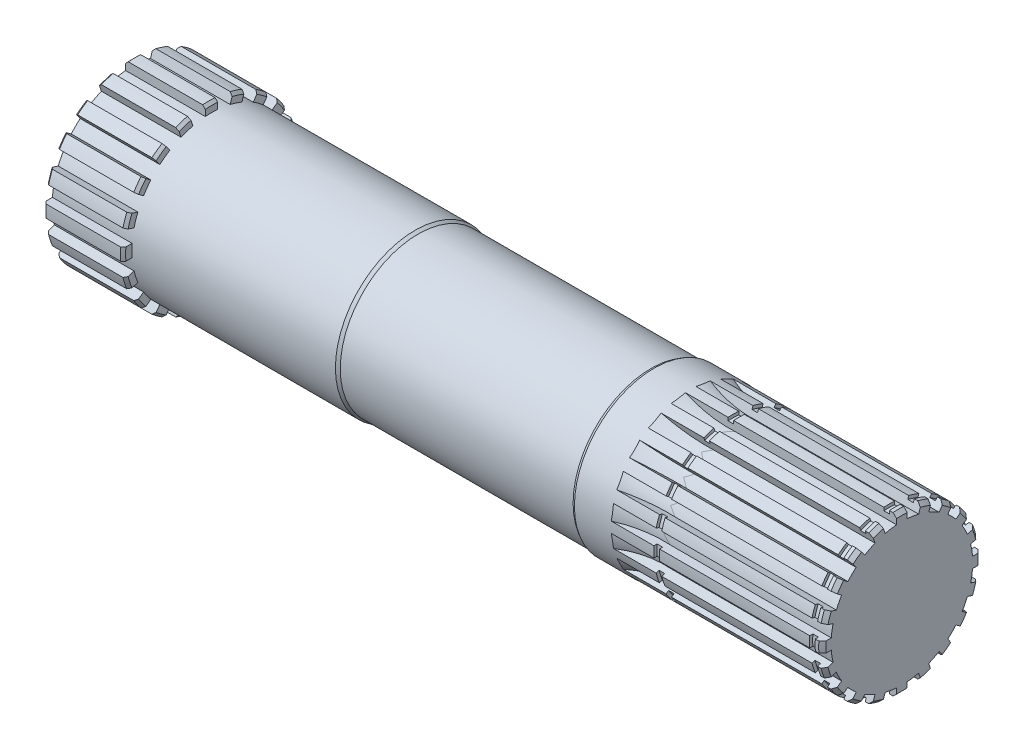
SolidWorks part; units mm, degrees
ref_plane "Face" through (0, 0, 0) normal (0, 0, 1) x (1, 0, 0)
ref_plane "Dessus" through (0, 0, 0) normal (0, 1, 0) x (1, 0, 0)
ref_plane "Droite" through (0, 0, 0) normal (1, 0, 0) x (0, 0, -1)
sketch "Esquisse1" plane through (0, 0, 0) normal (0, 0, 1) x (1, 0, 0)
  line L0 (-78.8416, 3.5275) -> (479.443, 3.5275) construction
  line L1 (-48.0336, 3.5275) -> (-48.0336, 52.0275)
  line L2 (-46.5336, 53.5275) -> (-4.5336, 53.5275)
  line L3 (-3.0336, 52.0275) -> (-3.0336, 48.5275)
  line L4 (-3.0336, 48.5275) -> (111.9664, 48.5275)
  line L5 (111.9664, 48.5275) -> (113.6984, 47.5275)
  line L6 (113.6984, 47.5275) -> (245.2343, 47.5275)
  line L7 (245.2343, 47.5275) -> (246.9664, 48.5275)
  line L8 (246.9664, 48.5275) -> (291.8164, 48.5275)
  line L9 (386.9664, 46.5275) -> (386.9664, 3.5275)
  line L10 (-48.0336, 52.0275) -> (-46.5336, 53.5275)
  line L11 (-4.5336, 53.5275) -> (-3.0336, 52.0275)
  line L12 (384.9664, 48.5275) -> (386.9664, 46.5275)
  line L13 (294.9664, 48.5275) -> (379.8164, 48.5275)
  line L14 (382.9664, 48.5275) -> (384.9664, 48.5275)
  line L15 (379.8164, 48.5275) -> (379.8164, 46.7775)
  line L16 (379.8164, 46.7775) -> (382.9664, 46.7775)
  line L17 (382.9664, 48.5275) -> (382.9664, 46.7775)
  line L18 (-48.0336, 3.5275) -> (386.9664, 3.5275)
  line L19 (291.8164, 48.5275) -> (291.8164, 46.7775)
  line L20 (291.8164, 46.7775) -> (294.9664, 46.7775)
  line L21 (294.9664, 48.5275) -> (294.9664, 46.7775)
  point P4 (-48.0336, 53.5275)
  point P6 (-3.0336, 53.5275)
  point P12 (386.9664, 48.5275)
  dimension "D1" = 100
  dimension "D2" = 90
  dimension "D3" = 88
  dimension "D4" = 90
  dimension "D5" = 45
  dimension "D6" = 115
  dimension "D7" = 435
  dimension "D8" = 150
  dimension "D9" = 150
  dimension "D10" = 135
  dimension "D11" = 1.5
  dimension "D12" = 45
  dimension "D13" = 1.5
  dimension "D14" = 45
  dimension "D15" = 2
  dimension "D16" = 45
  dimension "D17" = 3.15
  dimension "D18" = 3.15
  dimension "D19" = 386
  dimension "D20" = 298
  dimension "D21" = 86.5
revolve "Révolution1" add sketch "Esquisse1" angle 360 about L0
sketch "Esquisse2" plane through (-48.0336, 0, 0) normal (-1, 0, 0) x (0, 0, 1)
  line L0 (0, 3.5275) -> (0, 70.5299) construction
  line L1 (12.8849, 54.5095) -> (10.5349, 47.2769)
  line L3 (-3.5, 55.9959) -> (-3.5, 48.3912)
  line L5 (3.5, 55.9959) -> (3.5, 48.3912)
  line L6 (19.5423, 52.3464) -> (17.1923, 45.1138)
  line L7 (28.0086, 48.0326) -> (23.5387, 41.8802)
  line L9 (33.6717, 43.9181) -> (29.2018, 37.7657)
  line L10 (40.3906, 37.1992) -> (34.2382, 32.7292)
  line L12 (44.5051, 31.5361) -> (38.3527, 27.0661)
  line L13 (48.8189, 23.0698) -> (41.5863, 20.7198)
  line L15 (50.982, 16.4124) -> (43.7495, 14.0624)
  line L16 (52.4684, 7.0275) -> (44.8637, 7.0275)
  line L18 (52.4684, 0.0275) -> (44.8637, 0.0275)
  line L19 (50.982, -9.3575) -> (43.7495, -7.0075)
  line L21 (48.8189, -16.0149) -> (41.5863, -13.6649)
  line L22 (44.5051, -24.4811) -> (38.3527, -20.0112)
  line L24 (40.3906, -30.1443) -> (34.2382, -25.6743)
  line L25 (33.6717, -36.8631) -> (29.2018, -30.7108)
  line L27 (28.0086, -40.9776) -> (23.5387, -34.8253)
  line L28 (19.5423, -45.2914) -> (17.1923, -38.0589)
  line L30 (12.8849, -47.4545) -> (10.5349, -40.222)
  line L31 (3.5, -48.941) -> (3.5, -41.3362)
  line L33 (-3.5, -48.941) -> (-3.5, -41.3362)
  line L34 (-12.8849, -47.4545) -> (-10.5349, -40.222)
  line L36 (-19.5423, -45.2914) -> (-17.1923, -38.0589)
  line L37 (-28.0086, -40.9776) -> (-23.5387, -34.8253)
  line L39 (-33.6717, -36.8631) -> (-29.2018, -30.7108)
  line L40 (-40.3906, -30.1443) -> (-34.2382, -25.6743)
  line L42 (-44.5051, -24.4811) -> (-38.3527, -20.0112)
  line L43 (-48.8189, -16.0149) -> (-41.5863, -13.6649)
  line L45 (-50.982, -9.3575) -> (-43.7495, -7.0075)
  line L46 (-52.4684, 0.0275) -> (-44.8637, 0.0275)
  line L48 (-52.4684, 7.0275) -> (-44.8637, 7.0275)
  line L49 (-50.982, 16.4124) -> (-43.7495, 14.0624)
  line L51 (-48.8189, 23.0698) -> (-41.5863, 20.7198)
  line L52 (-44.5051, 31.5361) -> (-38.3527, 27.0661)
  line L54 (-40.3906, 37.1992) -> (-34.2382, 32.7292)
  line L55 (-33.6717, 43.9181) -> (-29.2018, 37.7657)
  line L57 (-28.0086, 48.0326) -> (-23.5387, 41.8802)
  line L58 (-19.5423, 52.3464) -> (-17.1923, 45.1138)
  line L60 (-12.8849, 54.5095) -> (-10.5349, 47.2769)
  line L61 (-20.5467, 55.4375) -> (-13.8893, 57.6006)
  line L62 (-35.5822, 46.5476) -> (-29.919, 50.6621)
  line L63 (-47.1346, 33.4465) -> (-43.0201, 39.1096)
  line L64 (-54.0732, 17.4168) -> (-51.91, 24.0742)
  line L65 (-55.7187, 0.0275) -> (-55.7187, 7.0275)
  line L66 (-51.91, -17.0192) -> (-54.0732, -10.3618)
  line L67 (-43.0201, -32.0547) -> (-47.1346, -26.3916)
  line L68 (0, 59.2461) -> (3.5, 59.2461)
  line L69 (13.8893, 57.6006) -> (20.5467, 55.4375)
  line L70 (29.919, 50.6621) -> (35.5822, 46.5476)
  line L71 (43.0201, 39.1096) -> (47.1346, 33.4465)
  line L72 (51.91, 24.0742) -> (54.0732, 17.4168)
  line L73 (55.7187, 7.0275) -> (55.7187, 0.0275)
  line L74 (54.0732, -10.3618) -> (51.91, -17.0192)
  line L75 (47.1346, -26.3916) -> (43.0201, -32.0547)
  line L76 (35.5822, -39.4926) -> (29.919, -43.6071)
  line L77 (20.5467, -48.3826) -> (13.8893, -50.5457)
  line L78 (3.5, -52.1912) -> (-3.5, -52.1912)
  line L79 (-13.8893, -50.5457) -> (-20.5467, -48.3826)
  line L80 (-29.919, -43.6071) -> (-35.5822, -39.4926)
  arc A0 (-3.5, 48.3912) -> (-10.5349, 47.2769) centre (0, 3.5275) ccw
  arc A1 (-40.3906, -30.1443) -> (-33.6717, -36.8631) centre (0, 3.5275) ccw
  arc A2 (10.5349, 47.2769) -> (3.5, 48.3912) centre (0, 3.5275) ccw
  arc A3 (23.5387, 41.8802) -> (17.1923, 45.1138) centre (0, 3.5275) ccw
  arc A4 (34.2382, 32.7292) -> (29.2018, 37.7657) centre (0, 3.5275) ccw
  arc A5 (41.5863, 20.7198) -> (38.3527, 27.0661) centre (0, 3.5275) ccw
  arc A6 (44.8637, 7.0275) -> (43.7495, 14.0624) centre (0, 3.5275) ccw
  arc A7 (43.7495, -7.0075) -> (44.8637, 0.0275) centre (0, 3.5275) ccw
  arc A8 (38.3527, -20.0112) -> (41.5863, -13.6649) centre (0, 3.5275) ccw
  arc A9 (29.2018, -30.7108) -> (34.2382, -25.6743) centre (0, 3.5275) ccw
  arc A10 (17.1923, -38.0589) -> (23.5387, -34.8253) centre (0, 3.5275) ccw
  arc A11 (3.5, -41.3362) -> (10.5349, -40.222) centre (0, 3.5275) ccw
  arc A12 (-10.5349, -40.222) -> (-3.5, -41.3362) centre (0, 3.5275) ccw
  arc A13 (-23.5387, -34.8253) -> (-17.1923, -38.0589) centre (0, 3.5275) ccw
  arc A14 (-34.2382, -25.6743) -> (-29.2018, -30.7108) centre (0, 3.5275) ccw
  arc A15 (-41.5863, -13.6649) -> (-38.3527, -20.0112) centre (0, 3.5275) ccw
  arc A16 (-44.8637, 0.0275) -> (-43.7495, -7.0075) centre (0, 3.5275) ccw
  arc A17 (-43.7495, 14.0624) -> (-44.8637, 7.0275) centre (0, 3.5275) ccw
  arc A18 (-38.3527, 27.0661) -> (-41.5863, 20.7198) centre (0, 3.5275) ccw
  arc A19 (-29.2018, 37.7657) -> (-34.2382, 32.7292) centre (0, 3.5275) ccw
  arc A20 (-17.1923, 45.1138) -> (-23.5387, 41.8802) centre (0, 3.5275) ccw
  arc A21 (-48.8189, -16.0149) -> (-44.5051, -24.4811) centre (0, 3.5275) ccw
  arc A22 (-52.4684, 0.0275) -> (-50.982, -9.3575) centre (0, 3.5275) ccw
  arc A23 (-50.982, 16.4124) -> (-52.4684, 7.0275) centre (0, 3.5275) ccw
  arc A24 (-44.5051, 31.5361) -> (-48.8189, 23.0698) centre (0, 3.5275) ccw
  arc A25 (-33.6717, 43.9181) -> (-40.3906, 37.1992) centre (0, 3.5275) ccw
  arc A26 (-19.5423, 52.3464) -> (-28.0086, 48.0326) centre (0, 3.5275) ccw
  arc A27 (-3.5, 55.9959) -> (-12.8849, 54.5095) centre (0, 3.5275) ccw
  arc A28 (28.0086, 48.0326) -> (19.5423, 52.3464) centre (0, 3.5275) ccw
  arc A29 (12.8849, 54.5095) -> (3.5, 55.9959) centre (0, 3.5275) ccw
  arc A30 (40.3906, 37.1992) -> (33.6717, 43.9181) centre (0, 3.5275) ccw
  arc A31 (48.8189, 23.0698) -> (44.5051, 31.5361) centre (0, 3.5275) ccw
  arc A32 (52.4684, 7.0275) -> (50.982, 16.4124) centre (0, 3.5275) ccw
  arc A33 (50.982, -9.3575) -> (52.4684, 0.0275) centre (0, 3.5275) ccw
  arc A34 (44.5051, -24.4811) -> (48.8189, -16.0149) centre (0, 3.5275) ccw
  arc A35 (33.6717, -36.8631) -> (40.3906, -30.1443) centre (0, 3.5275) ccw
  arc A36 (19.5423, -45.2914) -> (28.0086, -40.9776) centre (0, 3.5275) ccw
  arc A37 (3.5, -48.941) -> (12.8849, -47.4545) centre (0, 3.5275) ccw
  arc A38 (-12.8849, -47.4545) -> (-3.5, -48.941) centre (0, 3.5275) ccw
  arc A39 (-28.0086, -40.9776) -> (-19.5423, -45.2914) centre (0, 3.5275) ccw
  dimension "D1" = 3.5
  dimension "D3" = 90
  dimension "D2" = 3.5
extrude "Enlèv. mat.-Extru.1" cut sketch "Esquisse2" against normal blind 45
sketch "Esquisse3" plane through (386.9664, 0, 0) normal (1, 0, 0) x (0, 0, -1)
  line L0 (0, 3.5275) -> (0, 69.0717) construction
  line L1 (11.7386, 49.3632) -> (9.4727, 42.3896)
  line L2 (-3, 50.7473) -> (3, 50.7473)
  line L3 (-3, 50.7473) -> (-3, 43.4148)
  line L4 (11.7386, 49.3632) -> (17.4449, 47.5091)
  line L5 (3, 50.7473) -> (3, 43.4148)
  line L6 (17.4449, 47.5091) -> (15.179, 40.5355)
  line L7 (25.3281, 43.4925) -> (21.0181, 37.5604)
  line L8 (25.3281, 43.4925) -> (30.1822, 39.9658)
  line L9 (30.1822, 39.9658) -> (25.8722, 34.0337)
  line L10 (36.4383, 33.7096) -> (30.5062, 29.3997)
  line L11 (36.4383, 33.7096) -> (39.965, 28.8555)
  line L12 (39.965, 28.8555) -> (34.0329, 24.5456)
  line L13 (43.9817, 20.9724) -> (37.0081, 18.7065)
  line L14 (43.9817, 20.9724) -> (45.8358, 15.266)
  line L15 (45.8358, 15.266) -> (38.8622, 13.0002)
  line L16 (47.2198, 6.5275) -> (39.8873, 6.5275)
  line L17 (47.2198, 6.5275) -> (47.2198, 0.5275)
  line L18 (47.2198, 0.5275) -> (39.8873, 0.5275)
  line L19 (45.8358, -8.2111) -> (38.8622, -5.9452)
  line L20 (45.8358, -8.2111) -> (43.9817, -13.9174)
  line L21 (43.9817, -13.9174) -> (37.0081, -11.6516)
  line L22 (39.965, -21.8006) -> (34.0329, -17.4907)
  line L23 (39.965, -21.8006) -> (36.4383, -26.6547)
  line L24 (36.4383, -26.6547) -> (30.5062, -22.3448)
  line L25 (30.1822, -32.9108) -> (25.8722, -26.9787)
  line L26 (30.1822, -32.9108) -> (25.3281, -36.4375)
  line L27 (25.3281, -36.4375) -> (21.0181, -30.5054)
  line L28 (17.4449, -40.4542) -> (15.179, -33.4806)
  line L29 (17.4449, -40.4542) -> (11.7386, -42.3083)
  line L30 (11.7386, -42.3083) -> (9.4727, -35.3347)
  line L31 (3, -43.6924) -> (3, -36.3599)
  line L32 (3, -43.6924) -> (-3, -43.6924)
  line L33 (-3, -43.6924) -> (-3, -36.3599)
  line L34 (-11.7386, -42.3083) -> (-9.4727, -35.3347)
  line L35 (-11.7386, -42.3083) -> (-17.4449, -40.4542)
  line L36 (-17.4449, -40.4542) -> (-15.179, -33.4806)
  line L37 (-25.3281, -36.4375) -> (-21.0181, -30.5054)
  line L38 (-25.3281, -36.4375) -> (-30.1822, -32.9108)
  line L39 (-30.1822, -32.9108) -> (-25.8722, -26.9787)
  line L40 (-36.4383, -26.6547) -> (-30.5062, -22.3448)
  line L41 (-36.4383, -26.6547) -> (-39.965, -21.8006)
  line L42 (-39.965, -21.8006) -> (-34.0329, -17.4907)
  line L43 (-43.9817, -13.9174) -> (-37.0081, -11.6516)
  line L44 (-43.9817, -13.9174) -> (-45.8358, -8.2111)
  line L45 (-45.8358, -8.2111) -> (-38.8622, -5.9452)
  line L46 (-47.2198, 0.5275) -> (-39.8873, 0.5275)
  line L47 (-47.2198, 0.5275) -> (-47.2198, 6.5275)
  line L48 (-47.2198, 6.5275) -> (-39.8873, 6.5275)
  line L49 (-45.8358, 15.266) -> (-38.8622, 13.0002)
  line L50 (-45.8358, 15.266) -> (-43.9817, 20.9724)
  line L51 (-43.9817, 20.9724) -> (-37.0081, 18.7065)
  line L52 (-39.965, 28.8555) -> (-34.0329, 24.5456)
  line L53 (-39.965, 28.8555) -> (-36.4383, 33.7096)
  line L54 (-36.4383, 33.7096) -> (-30.5062, 29.3997)
  line L55 (-30.1822, 39.9658) -> (-25.8722, 34.0337)
  line L56 (-30.1822, 39.9658) -> (-25.3281, 43.4925)
  line L57 (-25.3281, 43.4925) -> (-21.0181, 37.5604)
  line L58 (-17.4449, 47.5091) -> (-15.179, 40.5355)
  line L59 (-17.4449, 47.5091) -> (-11.7386, 49.3632)
  line L60 (-11.7386, 49.3632) -> (-9.4727, 42.3896)
  arc A0 (-3, 43.4148) -> (-9.4727, 42.3896) centre (0, 3.5275) ccw
  arc A1 (9.4727, 42.3896) -> (3, 43.4148) centre (0, 3.5275) ccw
  arc A2 (21.0181, 37.5604) -> (15.179, 40.5355) centre (0, 3.5275) ccw
  arc A3 (30.5062, 29.3997) -> (25.8722, 34.0337) centre (0, 3.5275) ccw
  arc A4 (37.0081, 18.7065) -> (34.0329, 24.5456) centre (0, 3.5275) ccw
  arc A5 (39.8873, 6.5275) -> (38.8622, 13.0002) centre (0, 3.5275) ccw
  arc A6 (38.8622, -5.9452) -> (39.8873, 0.5275) centre (0, 3.5275) ccw
  arc A7 (34.0329, -17.4907) -> (37.0081, -11.6516) centre (0, 3.5275) ccw
  arc A8 (25.8722, -26.9787) -> (30.5062, -22.3448) centre (0, 3.5275) ccw
  arc A9 (15.179, -33.4806) -> (21.0181, -30.5054) centre (0, 3.5275) ccw
  arc A10 (3, -36.3599) -> (9.4727, -35.3347) centre (0, 3.5275) ccw
  arc A11 (-9.4727, -35.3347) -> (-3, -36.3599) centre (0, 3.5275) ccw
  arc A12 (-21.0181, -30.5054) -> (-15.179, -33.4806) centre (0, 3.5275) ccw
  arc A13 (-30.5062, -22.3448) -> (-25.8722, -26.9787) centre (0, 3.5275) ccw
  arc A14 (-37.0081, -11.6516) -> (-34.0329, -17.4907) centre (0, 3.5275) ccw
  arc A15 (-39.8873, 0.5275) -> (-38.8622, -5.9452) centre (0, 3.5275) ccw
  arc A16 (-38.8622, 13.0002) -> (-39.8873, 6.5275) centre (0, 3.5275) ccw
  arc A17 (-34.0329, 24.5456) -> (-37.0081, 18.7065) centre (0, 3.5275) ccw
  arc A18 (-25.8722, 34.0337) -> (-30.5062, 29.3997) centre (0, 3.5275) ccw
  arc A19 (-15.179, 40.5355) -> (-21.0181, 37.5604) centre (0, 3.5275) ccw
  dimension "D1" = 3
  dimension "D2" = 3
extrude "Enlèv. mat.-Extru.2" cut sketch "Esquisse3" against normal blind 95 flip side to cut
ref_plane "Plan2" through (0, 0.727, -1.4269) normal (0, -0.454, 0.891) x (1, 0, 0)
sketch "Esquisse7" plane through (386.9664, 0, 0) normal (1, 0, 0) x (0, 0, -1)
  line L0 (-22.7861, 39.9938) -> (-8.7063, 20.6146) construction
  line L2 (-16.1085, 43.3962) -> (-8.7063, 20.6146) construction
sketch "Esquisse8" plane through (0, 0.727, -1.4269) normal (0, -0.454, 0.891) x (1, 0, 0)
  line L0 (291.9664, 43.143) -> (291.9664, 134.4818) construction
  line L1 (291.9664, 42.9482) -> (291.9664, 45.2883) construction
  line L2 (291.9664, 43.0086) -> (291.9664, 43.143) construction
  line L3 (386.9664, 22.3204) -> (281.0498, 22.3204) construction
  circle A0 centre (291.9664, 103.143) radius 60
  dimension "D1" = 120
revolve "Enlèvement de matière-Révolution3" cut sketch "Esquisse8" angle 9 about L3
pattern_circular "Répétition circulaire2" count 20 over 360 about axis through (0, 3.5275, 0) along (1, 0, 0) of "Enlèvement de matière-Révolution3"
